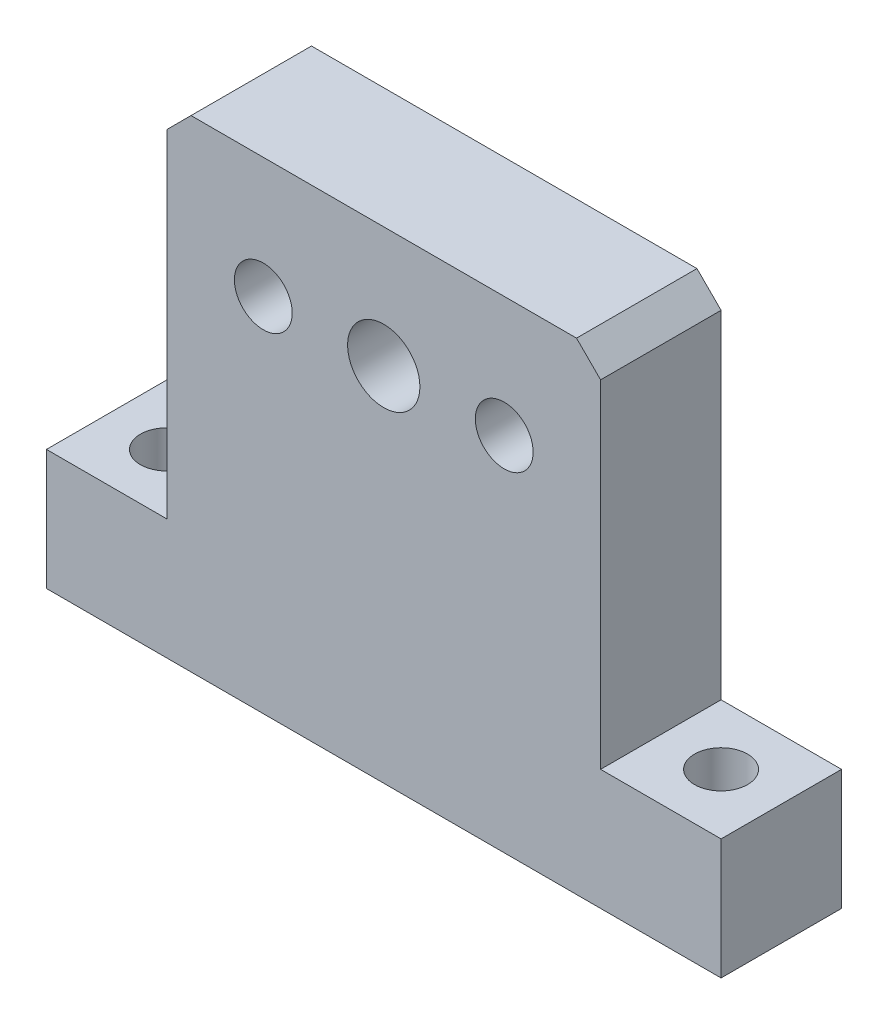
SolidWorks part; units mm, degrees
ref_plane "正面" through (0, 0, 0) normal (0, 0, 1) x (1, 0, 0)
ref_plane "平面" through (0, 0, 0) normal (0, 1, 0) x (1, 0, 0)
ref_plane "右側面" through (0, 0, 0) normal (1, 0, 0) x (0, 0, -1)
sketch "ｽｹｯﾁ1" plane through (0, 0, 0) normal (0, 0, 1) x (1, 0, 0)
  line L1 (-70, 100) -> (70, 100)
  line L2 (-70, 100) -> (-70, 0)
  line L3 (-70, 0) -> (70, 0)
  line L4 (70, 100) -> (70, 0)
  dimension "D1" = 140
  dimension "D2" = 100
extrude "押し出し1" add sketch "ｽｹｯﾁ1" along normal blind 25
sketch "ｽｹｯﾁ2" plane through (0, 0, 25) normal (0, 0, 1) x (1, 0, 0)
  line L0 (0, 0) -> (0, 100) construction
  line L1 (70, 100) -> (-70, 100) construction
  line L2 (45, 100) -> (45, 25)
  line L3 (-70, 100) -> (-45, 100)
  line L4 (-70, 100) -> (-70, 25)
  line L5 (-70, 25) -> (-45, 25)
  line L6 (-45, 100) -> (-45, 25)
  line L7 (70, 25) -> (45, 25)
  line L8 (70, 100) -> (70, 25)
  line L9 (70, 100) -> (45, 100)
  line L10 (-70, 0) -> (70, 0) construction
  dimension "D1" = 90
  dimension "D2" = 25
extrude "ｶｯﾄ - 押し出し1" cut sketch "ｽｹｯﾁ2" against normal through all
sketch "ｽｹｯﾁ3" plane through (0, 0, 25) normal (0, 0, 1) x (1, 0, 0)
  line L0 (0, 0) -> (0, 75) construction
  circle A0 centre (0, 75) radius 7.5
  dimension "D1" = 15
  dimension "D2" = 75
extrude "ｶｯﾄ - 押し出し2" cut sketch "ｽｹｯﾁ3" against normal through all
sketch "ｽｹｯﾁ4" plane through (0, 0, 25) normal (0, 0, 1) x (1, 0, 0)
  line L0 (-25, 75) -> (25, 75) construction
  circle A0 centre (-25, 75) radius 6
  circle A1 centre (25, 75) radius 6
  circle A2 centre (0, 75) radius 7.5 construction
  point P0 (0, 75)
  dimension "D1" = 12
  dimension "D2" = 50
extrude "ｶｯﾄ - 押し出し3" cut sketch "ｽｹｯﾁ4" against normal through all
sketch "ｽｹｯﾁ5" plane through (0, 25, 0) normal (0, 1, 0) x (1, 0, 0)
  line L0 (-57.5, -12.5) -> (57.5, -12.5) construction
  line L1 (0, 0) -> (0, -12.5) construction
  line L2 (45, 0) -> (-45, 0) construction
  circle A0 centre (-57.5, -12.5) radius 5.5
  circle A1 centre (57.5, -12.5) radius 5.5
  dimension "D1" = 11
  dimension "D2" = 115
  dimension "D3" = 12.5
extrude "ｶｯﾄ - 押し出し4" cut sketch "ｽｹｯﾁ5" against normal through all
chamfer "面取り1" distance 5 angle 45 2 edges at (45, 100, 12.5) (-45, 100, 12.5)
